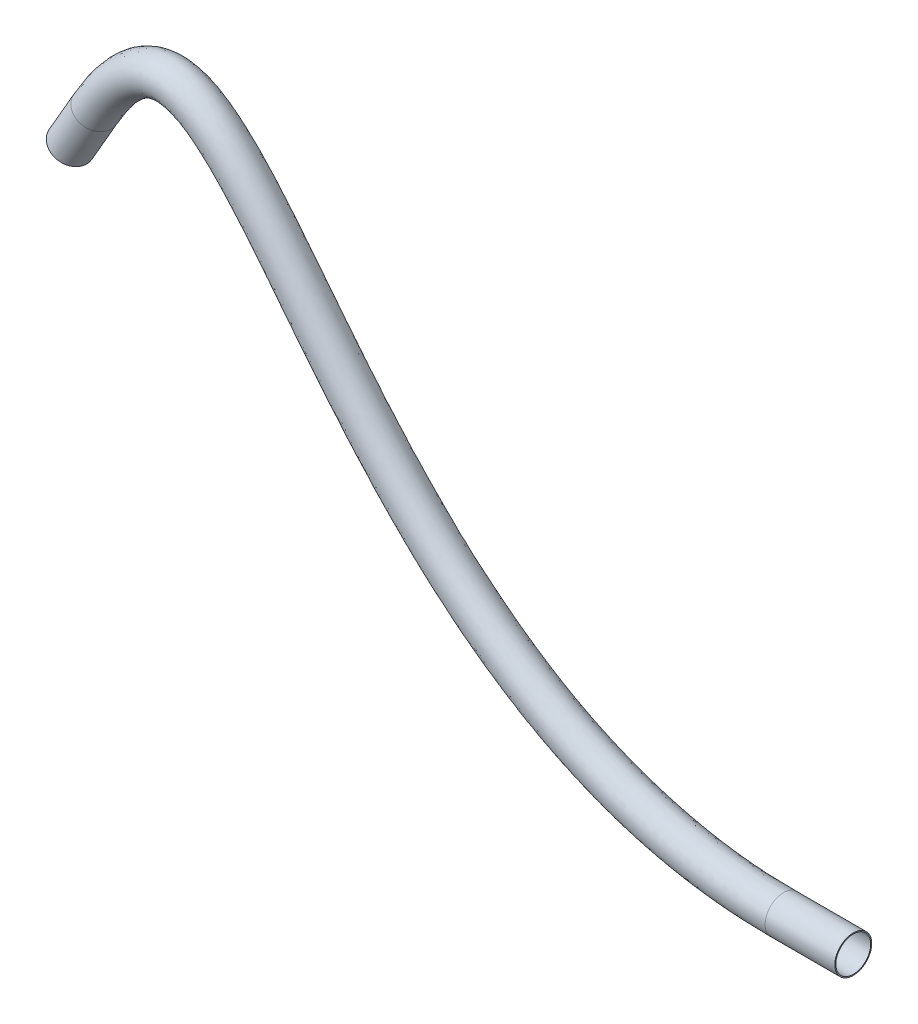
SolidWorks part; units mm, degrees
ref_plane "Front Plane" through (0, 0, 0) normal (0, 0, 1) x (1, 0, 0)
ref_plane "Top Plane" through (0, 0, 0) normal (0, 1, 0) x (1, 0, 0)
ref_plane "Right Plane" through (0, 0, 0) normal (1, 0, 0) x (0, 0, -1)
sketch "Sketch1" plane through (-38.0057, -57.7704, 21.2653) normal (0, 0, 1) x (1, 0, 0)
  line L0 (8.6458, 136.9709) -> (14.6458, 147.3632)
  line L1 (12.1099, 134.9709) -> (5.1817, 138.9709) construction
  line L2 (182.4, 61.3586) -> (199.4, 61.3586)
  line L3 (200, 68.8586) -> (200, 53.8586) construction
  line L4 (185.6316, 61.3586) -> (190.0649, 61.3586) construction
  line L5 (185.6316, 58.8107) -> (185.6316, 63.9065) construction
  line L6 (190.0649, 65.5201) -> (190.0649, 57.1971) construction
  spline S0 degree 3 poles (14.6458, 147.3632) (50.9648, 210.2695) (70.5612, 61.3586) (182.4, 61.3586) knots 0 0 0 0 1 1 1 1
  dimension "D1" = 17
  dimension "D2" = 12
  dimension "D3" = 0.6
ref_plane "Plane1" through (-29.3599, 79.2004, 21.2653) normal (0.5, 0.866, 0) x (0.866, -0.5, 0)
sketch "Sketch2" plane through (-29.3599, 79.2004, 21.2653) normal (0.5, 0.866, 0) x (0.866, -0.5, 0)
  line L0 (0, 0) -> (188.2817, 0) construction
  circle A0 centre (0, 0) radius 4.5
  circle A1 centre (0, 0) radius 4.25
  dimension "D1" = 9
  dimension "D2" = 8.5
sweep "Sweep1" add profiles "Sketch2" path "Sketch1"
